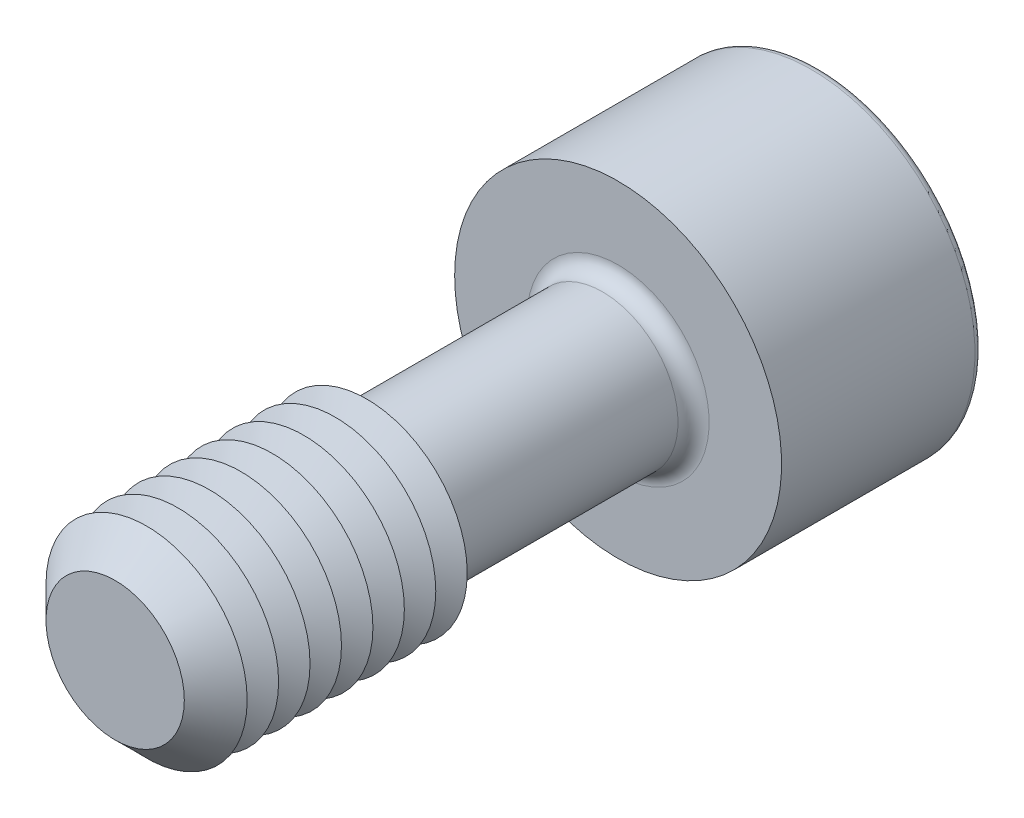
SolidWorks part; units mm, degrees
ref_plane "Front Plane" through (0, 0, 0) normal (0, 0, 1) x (1, 0, 0)
ref_plane "Top Plane" through (0, 0, 0) normal (0, 1, 0) x (1, 0, 0)
ref_plane "Right Plane" through (0, 0, 0) normal (1, 0, 0) x (0, 0, -1)
sketch "Sketch1" plane through (0, 0, 0) normal (0, 0, 1) x (1, 0, 0)
  circle A0 centre (0, 0) radius 3
  dimension "D1" = 6
extrude "Extrude1" add sketch "Sketch1" along normal mid plane 20
sketch "Sketch2" plane through (0, 0, 0) normal (1, 0, 0) x (0, 0, -1)
  line L0 (-10, 0) -> (-10, 4)
  line L1 (-10, 3) -> (-10, -3) construction
  line L2 (-10, 4) -> (0, 4)
  line L3 (0, 4) -> (0.5774, 3)
  line L4 (10, 3) -> (-10, 3) construction
  line L5 (0.5774, 3) -> (0.5774, 0)
  line L6 (0.5774, 0) -> (-10, 0)
  dimension "D1" = 4
  dimension "D2" = 120
  dimension "D3" = 10
revolve "Revolve1" add sketch "Sketch2" angle 360 about L6
chamfer "Chamfer1" distance 1.25 angle 45 1 edges at (0, 4, 10)
sketch "Sketch3" plane through (0, 0, -10) normal (0, 0, -1) x (-1, 0, 0)
  circle A0 centre (0, 0) radius 6.5
  dimension "D1" = 13
extrude "Extrude2" add sketch "Sketch3" along normal blind 8
sketch "Sketch4" plane through (-13.7, 0, -18) normal (0, 0, 1) x (1, 0, 0)
  line L2 (11.9679, -3) -> (15.4321, -3)
  line L3 (15.4321, -3) -> (17.1641, 0)
  line L4 (17.1641, 0) -> (15.4321, 3)
  line L6 (15.4321, 3) -> (11.9679, 3)
  line L7 (11.9679, 3) -> (10.2359, 0)
  line L8 (10.2359, 0) -> (11.9679, -3)
  circle A0 centre (13.7, 0) radius 3 construction
  dimension "D1" = 6
extrude "Extrude3" cut sketch "Sketch4" along normal blind 6
fillet "Fillet1" radius 0.62 1 edges at (-3, 0, -10)
fillet "Fillet2" radius 0.31 1 edges at (-6.5, 0, -18)
sketch "Sketch5" plane through (0, 0, 0) normal (1, 0, 0) x (0, 0, -1)
  line L0 (12, 0) -> (12, -3)
  line L1 (12, -3) -> (10.2679, 0)
  line L2 (10.2679, 0) -> (12, 0)
  dimension "D1" = 30
revolve "Cut-Revolve1" cut sketch "Sketch5" angle 360 about L2
sketch "Sketch6" plane through (0, 0, 0) normal (1, 0, 0) x (0, 0, -1)
  line L0 (1.332, 0) -> (-13.289, 0) construction
sketch "Sketch7" plane through (0, 0, 0) normal (1, 0, 0) x (0, 0, -1)
  line L0 (0, 4) -> (-0.625, 2.9175)
  line L1 (-0.625, 2.9175) -> (-1.25, 4)
  line L2 (0, 4) -> (-8.75, 4) construction
  line L3 (-1.25, 4) -> (0, 4)
  dimension "D1" = 1.25
revolve "Cut-Revolve2" cut sketch "Sketch7" angle 360 about L0
pattern_linear "LPattern1" count 7 spacing 1.25 along (0, 0, 1) of "Cut-Revolve2"
